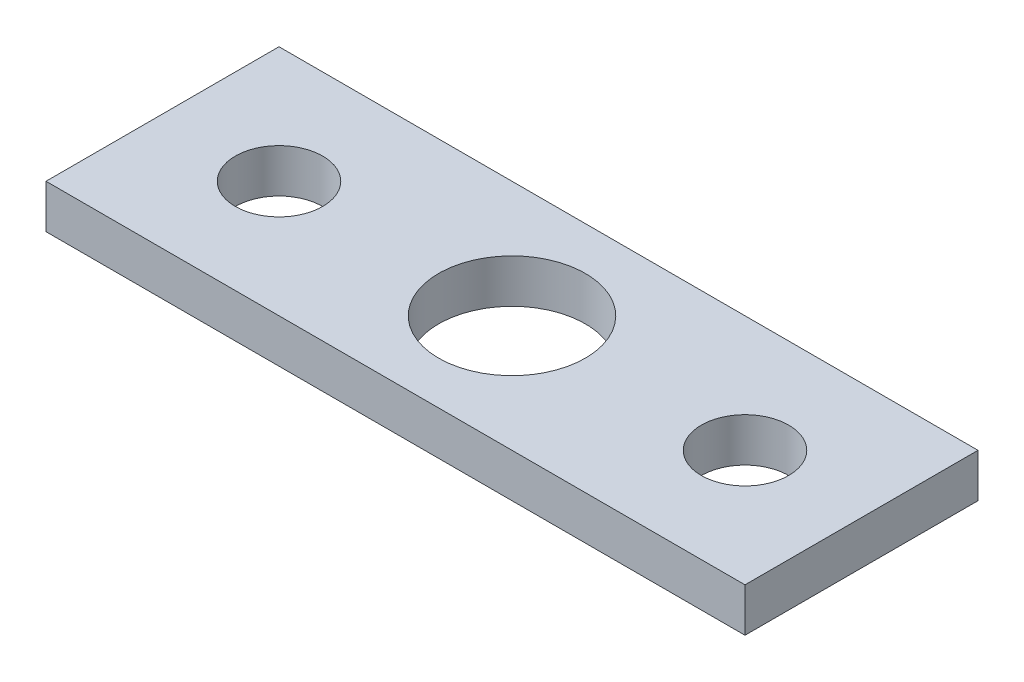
SolidWorks part; units mm, degrees
ref_plane "Front Plane" through (0, 0, 0) normal (0, 0, 1) x (1, 0, 0)
ref_plane "Top Plane" through (0, 0, 0) normal (0, 1, 0) x (1, 0, 0)
ref_plane "Right Plane" through (0, 0, 0) normal (1, 0, 0) x (0, 0, -1)
sketch "Sketch1" plane through (0, 0, 0) normal (0, 1, 0) x (1, 0, 0)
  line L1 (-76.2, 25.4) -> (76.2, 25.4)
  line L2 (-76.2, 25.4) -> (-76.2, -25.4)
  line L3 (-76.2, -25.4) -> (76.2, -25.4)
  line L4 (76.2, 25.4) -> (76.2, -25.4)
  dimension "D1" = 76.2
  dimension "D2" = 25.4
  dimension "D3" = 152.4
  dimension "D4" = 50.8
extrude "Extrude1" add sketch "Sketch1" along normal blind 9.525
sketch "Sketch2" plane through (0, 9.525, 0) normal (0, 1, 0) x (-1, 0, 0)
  circle A0 centre (0, 0) radius 16.002
  dimension "D1" = 32.004
extrude "Cut-Extrude1" cut sketch "Sketch2" against normal through all
sketch "Sketch3" plane through (0, 9.525, 0) normal (0, 1, 0) x (-1, 0, 0)
  line L0 (-76.2, 25.4) -> (-76.2, -25.4) construction
  line L1 (76.2, -25.4) -> (76.2, 25.4) construction
  circle A0 centre (-50.8, 0) radius 9.525
  circle A4 centre (50.8, 0) radius 9.525
  point P2 (-76.2, 0)
  dimension "D1" = 19.05
  dimension "D3" = 19.05
  dimension "D2" = 25.4
  dimension "D4" = 25.4
extrude "Cut-Extrude2" cut sketch "Sketch3" against normal through all
sketch "Sketch4" [suppressed] plane through (0, 0, 25.4) normal (0, 0, 1) x (1, 0, 0)
  line L0 (-76.2, 4.7625) -> (76.2, 4.7625) construction
  line L1 (-76.2, 9.525) -> (-76.2, 0) construction
  line L2 (76.2, 9.525) -> (76.2, 0) construction
  line L3 (0, 9.525) -> (0, 0) construction
  line L4 (-76.2, 9.525) -> (76.2, 9.525) construction
  point P6 (-31.75, 4.7625)
  point P7 (-19.05, 4.7625)
  dimension "D1" = 12.7
  dimension "D2" = 19.05
hole_wizard "#6-32 Tapped Hole1" positions "3DSketch1" profile "Sketch5" tap size "#6-32" standard "Ansi Inch"
sketch3d "3DSketch1" [suppressed]
  point P0 (-31.75, 4.7625, 25.4)
  point P3 (-19.05, 4.7625, 25.4)
sketch "Sketch5" plane through (-31.75, 4.7625, 25.4) normal (1, 0, 0) x (0, -1, 0)
  line L0 (0, 0) -> (0, 11.9887)
  line L1 (0, 11.9887) -> (1.3525, 11.176)
  line L2 (1.3525, 11.176) -> (1.3525, 7.112)
  line L3 (1.3525, 7.112) -> (1.7526, 7.112)
  line L4 (1.7526, 7.112) -> (1.7526, 0)
  line L5 (1.7526, 0) -> (0, 0)
  line L10 (0, 11.9887) -> (-1.3526, 11.176) construction
  line L11 (0, -6.35) -> (0, 107.95) construction
  dimension "Tap Drill Dia." = 2.7051
  dimension "Tap Drill Depth" = 11.176
  dimension "Thread Major Dia." = 3.5052
  dimension "Thread Depth" = 7.112
  dimension "Drill Angle" = 118
equation "\"D1@Sketch1\" = \"D3@Sketch1\"/2"
equation "\"D2@Sketch1\" = \"D4@Sketch1\"/2"
equation "\"D3@Sketch3\" = \"D1@Sketch3\""
equation "\"D4@Sketch3\" = \"D2@Sketch3\""
